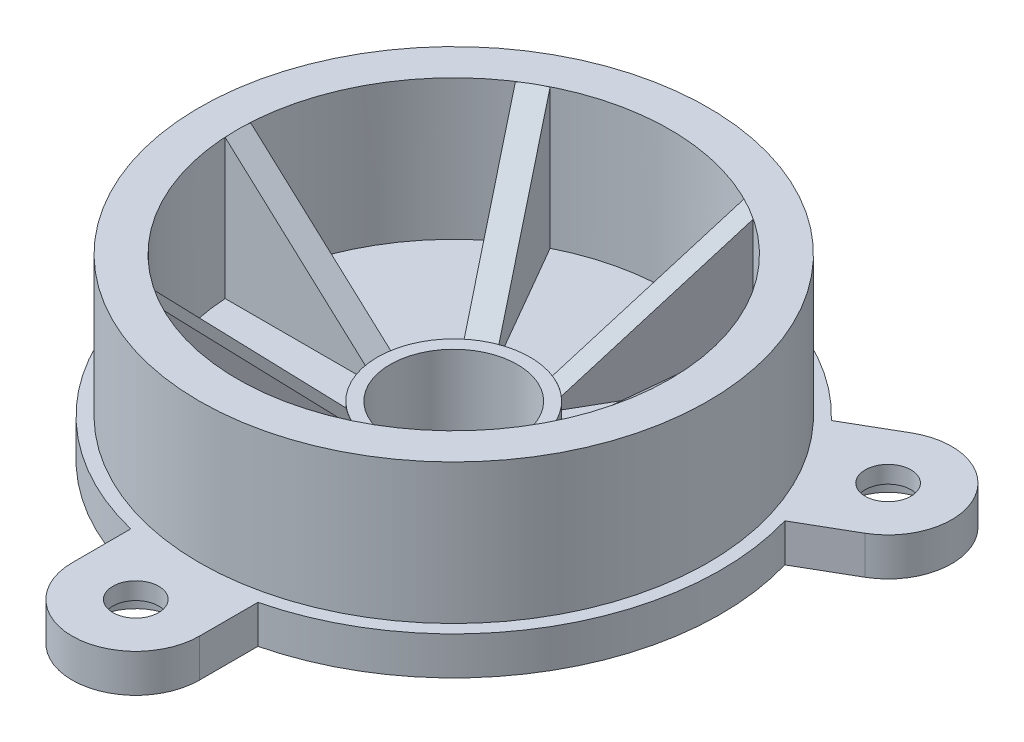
SolidWorks part; units mm, degrees
ref_plane "Front Plane" through (0, 0, 0) normal (0, 0, 1) x (1, 0, 0)
ref_plane "Top Plane" through (0, 0, 0) normal (0, 1, 0) x (1, 0, 0)
ref_plane "Right Plane" through (0, 0, 0) normal (1, 0, 0) x (0, 0, -1)
sketch "Sketch1" plane through (0, 0, 0) normal (1, 0, 0) x (0, 0, -1)
  line L0 (0, 20.1193) -> (0, 0) construction
  line L1 (5, 0) -> (5, 6)
  line L2 (5, 6) -> (6, 6)
  line L3 (6, 6) -> (6, 5)
  line L4 (6, 5) -> (17, 5)
  line L5 (17, 5) -> (17, 16)
  line L6 (17, 16) -> (20, 16)
  line L7 (20, 16) -> (20, 5)
  line L8 (20, 5) -> (21, 5)
  line L9 (21, 5) -> (21, 2)
  line L10 (21, 2) -> (10, 2)
  line L11 (10, 2) -> (10, 0)
  line L12 (10, 0) -> (5, 0)
  dimension "D1" = 42
  dimension "D2" = 40
  dimension "D3" = 34
  dimension "D4" = 20
  dimension "D5" = 10
  dimension "D6" = 12
  dimension "D7" = 1
  dimension "D8" = 2
  dimension "D9" = 3
  dimension "D10" = 11
revolve "Revolve1" add sketch "Sketch1" angle 360 about L0
sketch "Sketch2" plane through (0, 5, 0) normal (0, 1, 0) x (1, 0, 0)
  line L0 (0, 0) -> (0, -21) construction
  line L1 (-5, -19.3649) -> (-5, -25)
  line L2 (5, -25) -> (5, -19.3649)
  circle A0 centre (0, 0) radius 21 construction
  circle A1 centre (0, 0) radius 20 construction
  arc A2 (-5, -25) -> (5, -25) centre (0, -25) ccw
  circle A3 centre (0, 0) radius 20 construction
  arc A4 (-5, -19.3649) -> (5, -19.3649) centre (0, 0) ccw
  circle A5 centre (0, 0) radius 25 construction
  dimension "D1" = 5
  dimension "D2" = 50
extrude "Boss-Extrude1" add sketch "Sketch2" against normal up to surface (3 mm away)
hole_wizard "CBORE for M3 SBHCS1" positions "Sketch4" profile "Sketch3" counterbore size "M3" standard "Ansi Metric"
sketch "Sketch4" plane through (0, 2, 0) normal (0, -1, 0) x (1, 0, 0)
  arc A0 (5, 25) -> (-5, 25) centre (0, 25) ccw construction
  point P0 (0, 25)
sketch "Sketch3" plane through (0, 2, 25) normal (1, 0, 0) x (0, 0, -1)
  line L0 (0, 0) -> (0, 3.001)
  line L1 (0, 3.001) -> (1.8, 3.001)
  line L3 (1.8, 3.001) -> (1.8, 1.65)
  line L4 (1.8, 1.65) -> (3.35, 1.65)
  line L5 (3.35, 1.65) -> (3.35, 0)
  line L7 (3.35, 0) -> (0, 0)
  line L11 (0, -6.35) -> (0, 107.95) construction
  dimension "Thru Hole Dia." = 3.6
  dimension "Thru Hole Depth" = 3.001
  dimension "C'Bore Dia." = 6.7
  dimension "C'Bore Depth" = 1.65
pattern_circular "CirPattern1" count 3 over 360 about axis through (0, 0, 0) along (0, 1, 0) of "Boss-Extrude1", "CBORE for M3 SBHCS1"
sketch "Sketch5" plane through (0, 0, 0) normal (0, 0, 1) x (1, 0, 0)
  line L0 (-6, 6) -> (-17, 16)
rib "Rib1" sketch "Sketch5" sketch "Sketch5" thickness 2 extrusion direction parallel to sketch draft on no parameters "D1"=2
pattern_circular "CirPattern2" count 6 over 360 about axis through (0, 0, 0) along (0, 1, 0) of "Rib1"
